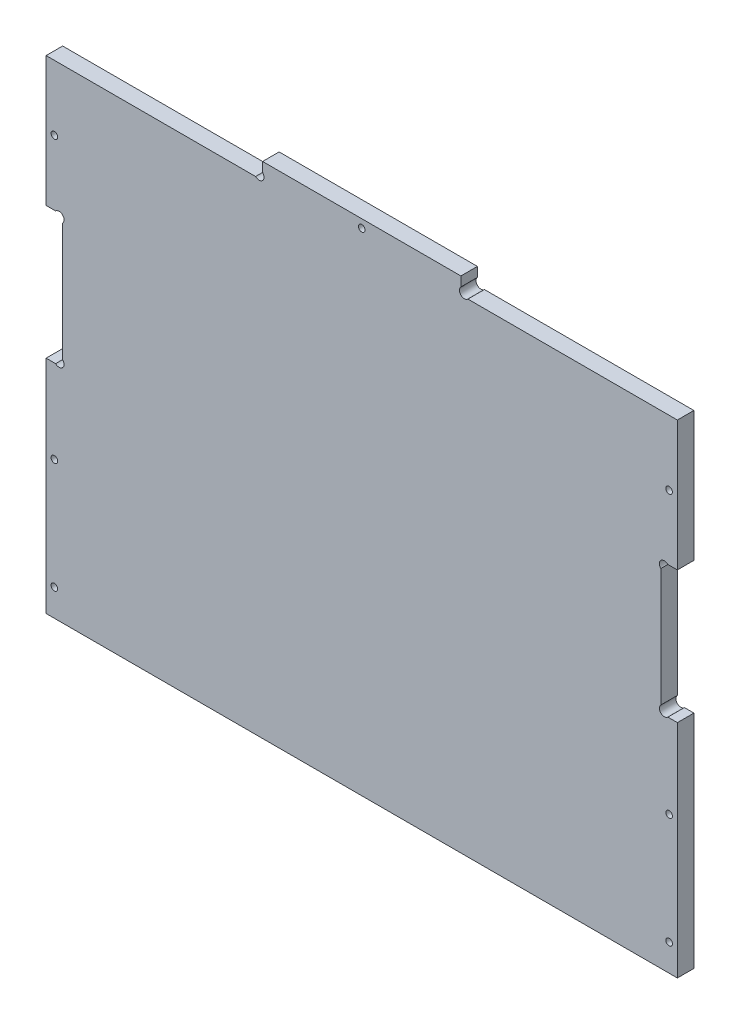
SolidWorks part; units mm, degrees
ref_plane "Plan de face" through (0, 0, 0) normal (0, 0, 1) x (1, 0, 0)
ref_plane "Plan de dessus" through (0, 0, 0) normal (0, 1, 0) x (1, 0, 0)
ref_plane "Plan de droite" through (0, 0, 0) normal (1, 0, 0) x (0, 0, -1)
sketch "Esquisse1" plane through (0, 0, 0) normal (0, 0, 1) x (1, 0, 0)
  line L0 (0, -110.5613) -> (0, 40.6487)
  line L1 (-30, 40.6487) -> (30, 40.6487)
  line L2 (-30, 40.6487) -> (-30, 37.77)
  line L3 (-32.1213, 35.6487) -> (-95.5, 35.6487)
  line L4 (-95.5, 35.6487) -> (-95.5, -3.6413)
  line L5 (-95.5, -3.6413) -> (-92.6213, -3.6413)
  line L6 (-90.5, -5.7626) -> (-90.5, -41.52)
  line L7 (-92.6213, -43.6413) -> (-95.5, -43.6413)
  line L8 (-95.5, -43.6413) -> (-95.5, -110.5613)
  line L9 (-95.5, -110.5613) -> (95.5, -110.5613)
  line L10 (-30, 35.6487) -> (-36.6646, 42.3133) construction
  line L11 (-90.5, -3.6413) -> (-101.6222, -14.7635) construction
  line L12 (-90.5, -43.6413) -> (-101.8247, -32.3166) construction
  line L13 (-90.5, -43.6413) -> (-95.5, -94.2013) construction
  line L14 (-95.5, -94.2013) -> (-90.5, -110.5613) construction
  line L15 (-90.5, -3.6413) -> (-95.5, 35.6487) construction
  line L16 (90.5, -3.6413) -> (95.5, 35.6487) construction
  line L17 (95.5, -94.2013) -> (90.5, -110.5613) construction
  line L18 (90.5, -43.6413) -> (95.5, -94.2013) construction
  line L19 (90.5, -43.6413) -> (101.8247, -32.3166) construction
  line L20 (90.5, -3.6413) -> (101.6222, -14.7635) construction
  line L21 (30, 35.6487) -> (36.6646, 42.3133) construction
  line L22 (95.5, -43.6413) -> (95.5, -110.5613)
  line L23 (92.6213, -43.6413) -> (95.5, -43.6413)
  line L24 (90.5, -5.7626) -> (90.5, -41.52)
  line L25 (95.5, -3.6413) -> (92.6213, -3.6413)
  line L26 (95.5, 35.6487) -> (95.5, -3.6413)
  line L27 (32.1213, 35.6487) -> (95.5, 35.6487)
  line L28 (30, 40.6487) -> (30, 37.77)
  arc A0 (-32.1213, 35.6487) -> (-30, 37.77) centre (-31.0607, 36.7093) ccw
  arc A1 (-90.5, -5.7626) -> (-92.6213, -3.6413) centre (-91.5607, -4.702) ccw
  arc A2 (-92.6213, -43.6413) -> (-90.5, -41.52) centre (-91.5607, -42.5807) ccw
  circle A3 centre (-93, -68.9213) radius 1
  circle A4 centre (-93, -102.3813) radius 1
  circle A5 centre (93, 16.0037) radius 1
  circle A6 centre (-93, 16.0037) radius 1
  circle A7 centre (93, -102.3813) radius 1
  circle A8 centre (93, -68.9213) radius 1
  arc A9 (92.6213, -43.6413) -> (90.5, -41.52) centre (91.5607, -42.5807) cw
  arc A10 (90.5, -5.7626) -> (92.6213, -3.6413) centre (91.5607, -4.702) cw
  arc A11 (32.1213, 35.6487) -> (30, 37.77) centre (31.0607, 36.7093) cw
  circle A12 centre (0, 38.1487) radius 1
  dimension "D11" = 16.36
  dimension "D12" = 5
  dimension "D7" = 5
  dimension "D2" = 45
  dimension "D3" = 95.5
  dimension "D4" = 39.29
  dimension "D5" = 40
  dimension "D6" = 5
  dimension "D8" = 151.21
  dimension "D9" = 45
  dimension "D10" = 45
  dimension "D13" = 2.5
extrude "Boss.-Extru.1" add sketch "Esquisse1" along normal blind 5
sketch "Esquisse3" plane through (0, 0, 5) normal (0, 0, 1) x (1, 0, 0)
  line L0 (-98.8207, -94.2013) -> (98.0364, -94.2013)
  line L1 (-95.5, -110.5613) -> (95.5, -110.5613) construction
  dimension "D1" = 16.36
